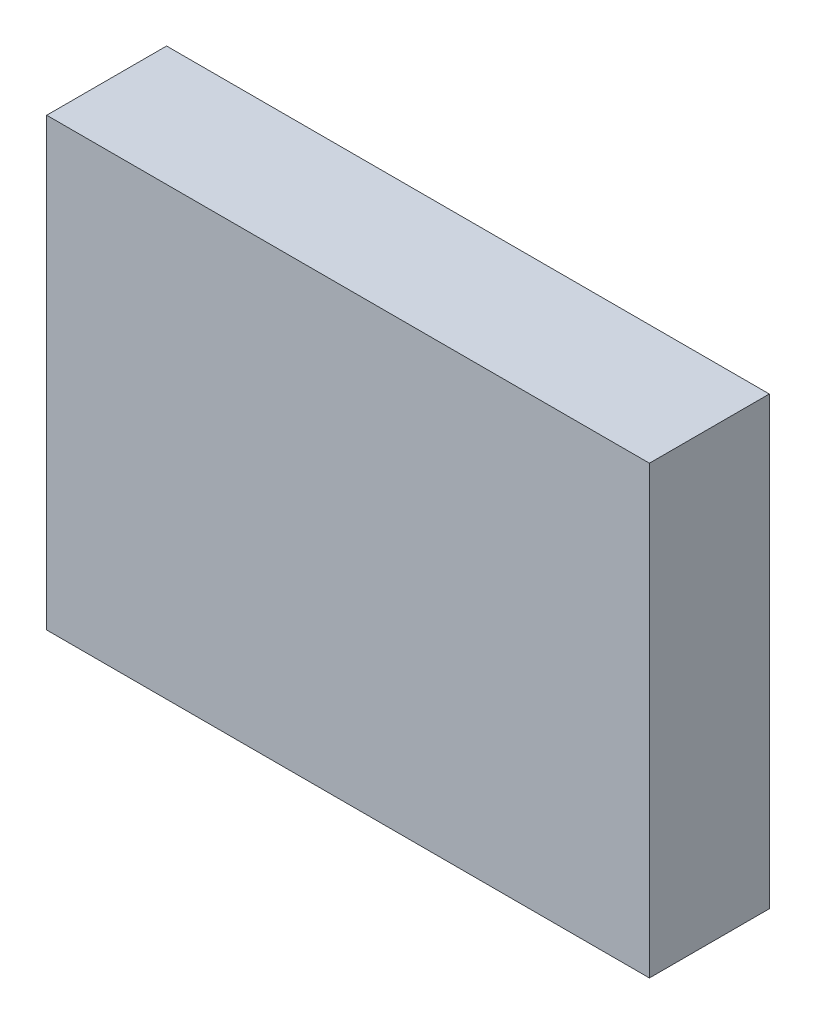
SolidWorks part; units mm, degrees
ref_plane "Plan de face" through (0, 0, 0) normal (0, 0, 1) x (1, 0, 0)
ref_plane "Plan de dessus" through (0, 0, 0) normal (0, 1, 0) x (1, 0, 0)
ref_plane "Plan de droite" through (0, 0, 0) normal (1, 0, 0) x (0, 0, -1)
sketch "Esquisse1" plane through (0, 0, 0) normal (0, 0, 1) x (1, 0, 0)
  line L1 (-12.3962, 23.2428) -> (37.8772, 23.2428)
  line L2 (-12.3962, 23.2428) -> (-12.3962, -13.9457)
  line L3 (-12.3962, -13.9457) -> (37.8772, -13.9457)
  line L4 (37.8772, 23.2428) -> (37.8772, -13.9457)
extrude "Extrusion1" add sketch "Esquisse1" along normal blind 10
